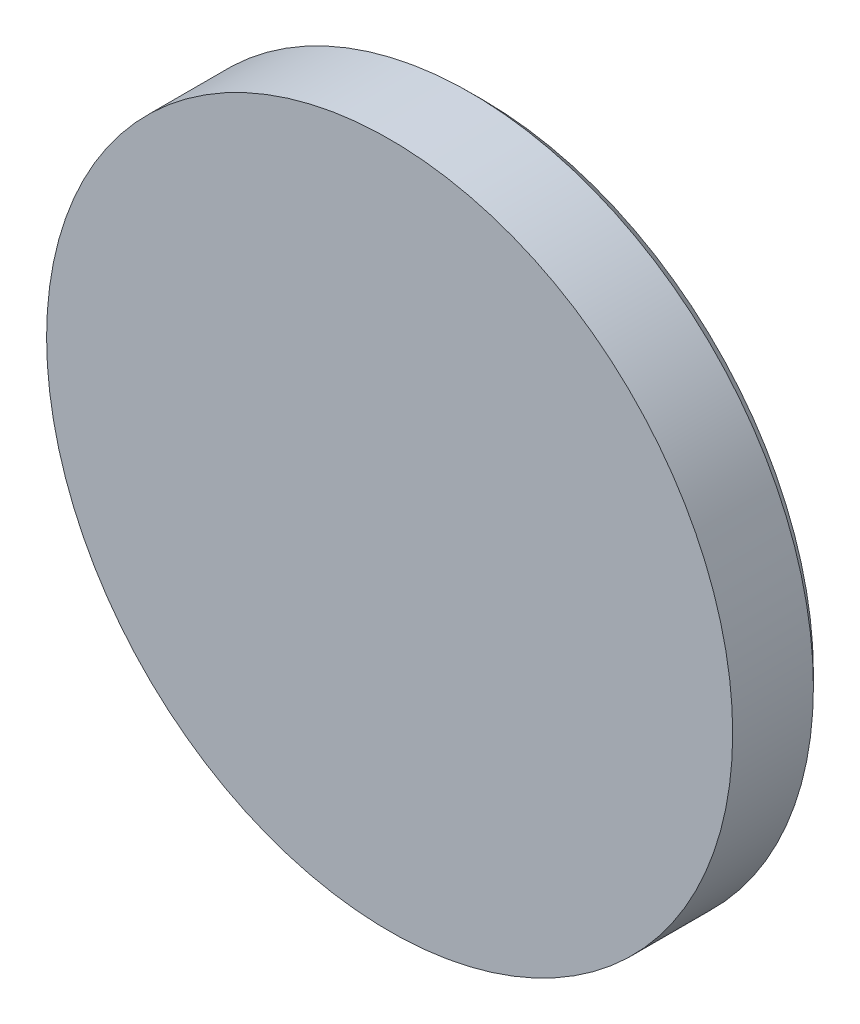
SolidWorks part; units mm, degrees
ref_plane "Plan 1" through (0, 0, 0) normal (0, 0, 1) x (1, 0, 0)
ref_plane "Plan 2" through (0, 0, 0) normal (0, 1, 0) x (1, 0, 0)
ref_plane "Plan 3" through (0, 0, 0) normal (1, 0, 0) x (0, 0, -1)
sketch "Esquisse1" plane through (0, 0, 0) normal (0, 0, 1) x (1, 0, 0)
  circle A0 centre (0, 0) radius 85
  dimension "D1" = 170
extrude "Brut" add sketch "Esquisse1" along normal blind 25
sketch "Esquisse2" plane through (0, 0, 0) normal (0, 0, -1) x (-1, 0, 0)
  circle A0 centre (0, 0) radius 74
  dimension "D1" = 148
extrude "Dressage" cut sketch "Esquisse2" against normal blind 2 flip side to cut
chamfer "Chanfrein" distance 3 angle 45 1 edges at (-85, 0, 2)
ref_plane "Plan1" through (85, 0, 15) normal (1, 0, 0) x (0, -1, 0)
ref_plane "Plan2" through (-85, 0, 15) normal (-1, 0, 0) x (0, 1, 0)
